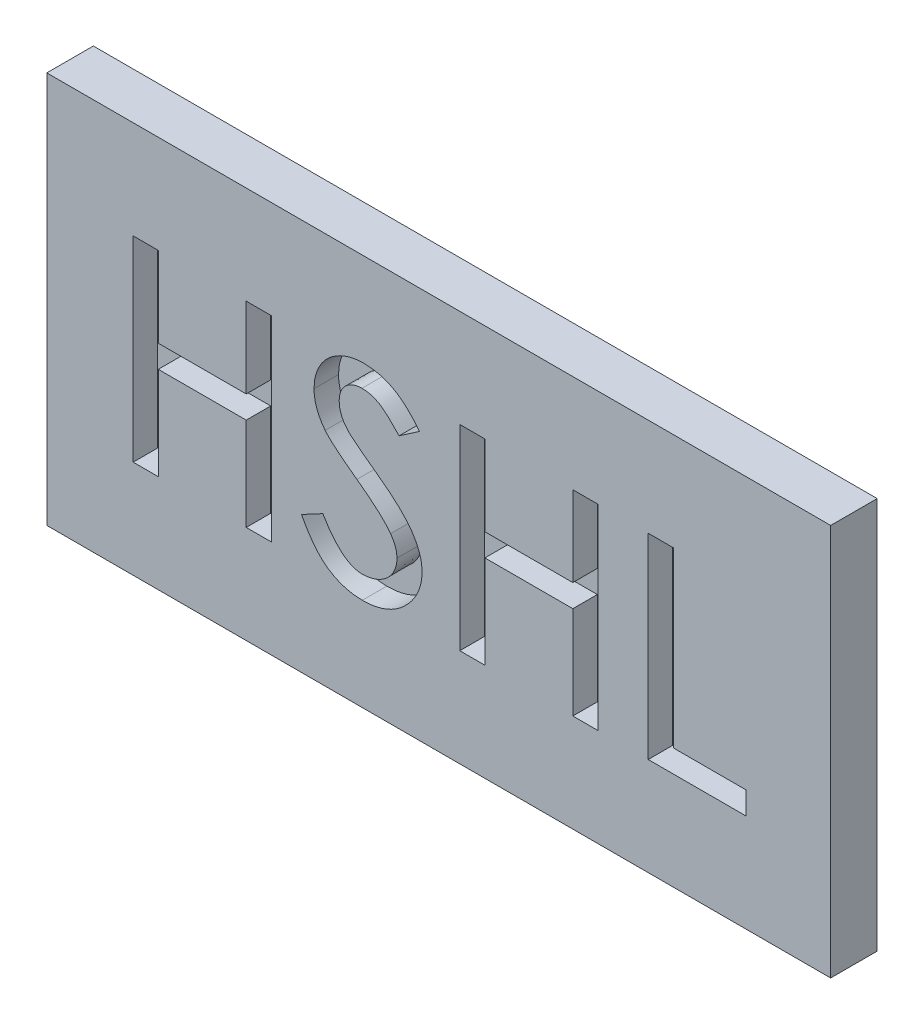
SolidWorks part; units mm, degrees
ref_plane "Ebene vorne" through (0, 0, 0) normal (0, 0, 1) x (1, 0, 0)
ref_plane "Ebene oben" through (0, 0, 0) normal (0, 1, 0) x (1, 0, 0)
ref_plane "Ebene rechts" through (0, 0, 0) normal (1, 0, 0) x (0, 0, -1)
sketch "Skizze1" plane through (0, 0, 0) normal (0, 0, 1) x (1, 0, 0)
  line L1 (-32, -16) -> (32, -16)
  line L2 (-32, -16) -> (-32, 16)
  line L3 (-32, 16) -> (32, 16)
  line L4 (32, -16) -> (32, 16)
  line L5 (-32, -16) -> (32, 16) construction
  line L6 (-32, 16) -> (32, -16) construction
  text T0 "<b>HSHL</b>" font "Century Gothic" height 16
  point P0 (0, 0)
  dimension "D1" = 64
  dimension "D2" = 32
  dimension "D3" = 8
  dimension "D4" = 5
extrude "Aufsatz-Linear austragen3" add sketch "Skizze1" along normal blind 4
sketch "Skizze2" plane through (0, 0, 0) normal (0, 0, -1) x (-1, 0, 0)
  line L0 (32, -16) -> (-32, -16) construction
  line L1 (32, 16) -> (32, -16) construction
  line L2 (-32, 16) -> (32, 16) construction
  line L3 (-32, -16) -> (-32, 16) construction
  line L4 (32, -16) -> (-32, -16)
  line L5 (32, 16) -> (32, -16)
  line L6 (-32, 16) -> (32, 16)
  line L7 (-32, -16) -> (-32, 16)
extrude "Aufsatz-Linear austragen4" add sketch "Skizze2" against normal blind 2
chamfer "Fase1" distance 0.2 angle 45 4 edges at (0, 16, 0) (-32, 0, 0) (0, -16, 0) (32, 0, 0)
